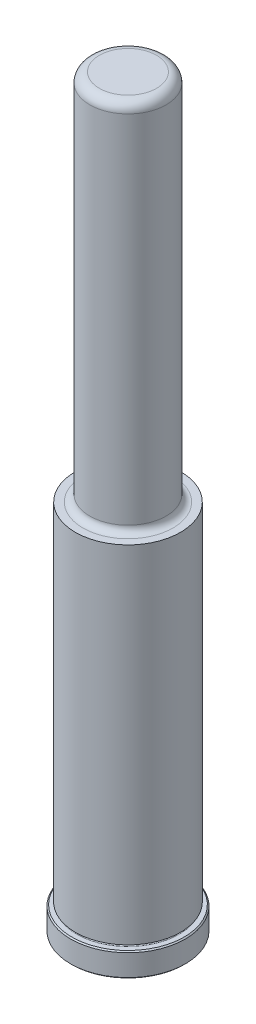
SolidWorks part; units mm, degrees
ref_plane "Front Plane" through (0, 0, 0) normal (0, 0, 1) x (1, 0, 0)
ref_plane "Top Plane" through (0, 0, 0) normal (0, 1, 0) x (1, 0, 0)
ref_plane "Right Plane" through (0, 0, 0) normal (1, 0, 0) x (0, 0, -1)
sketch "Sketch1" plane through (0, 0, 0) normal (1, 0, 0) x (0, 0, -1)
  line L0 (0, 0) -> (19.05, 0)
  line L1 (19.05, 0) -> (19.05, 7.9248)
  line L2 (19.05, 7.9248) -> (17.0688, 7.9248)
  line L3 (16.6878, 2.6782) -> (16.6878, 5.9795) construction
  line L4 (17.0688, 8.6868) -> (17.4752, 8.6868)
  line L5 (17.4752, 8.6868) -> (17.4752, 123.825)
  line L6 (17.4752, 123.825) -> (14.9733, 123.825)
  line L7 (12.6873, 126.111) -> (12.6873, 247.65)
  line L9 (12.6873, 247.65) -> (0, 247.65)
  line L10 (0, 247.65) -> (0, 0)
  line L11 (0, 0) -> (0, -7.2694) construction
  arc A0 (17.0688, 8.6868) -> (17.0688, 7.9248) centre (17.0688, 8.3058) ccw
  arc A1 (14.9733, 123.825) -> (12.6873, 126.111) centre (14.9733, 126.111) cw
  point P19 (12.6873, 123.825)
  dimension "D14" = 0.762
  dimension "D8" = 2.286
  dimension "T" = 7.9248
  dimension "D2" = 0.762
  dimension "M" = 38.1
  dimension "B" = 34.9504
  dimension "L" = 247.65
  dimension "D7" = 0.7874
  dimension "A" = 123.825
  dimension "D" = 25.3746
  dimension "D15" = 123.825
revolve "Revolve1" add sketch "Sketch1" angle 360 about L11
chamfer "Chamfer1" distance 0.381 angle 45 2 edges at (0, 0, 19.05) (0, 7.9248, 19.05)
fillet "Fillet7" radius 3.175 1 edges at (0, 247.65, 12.6873)
